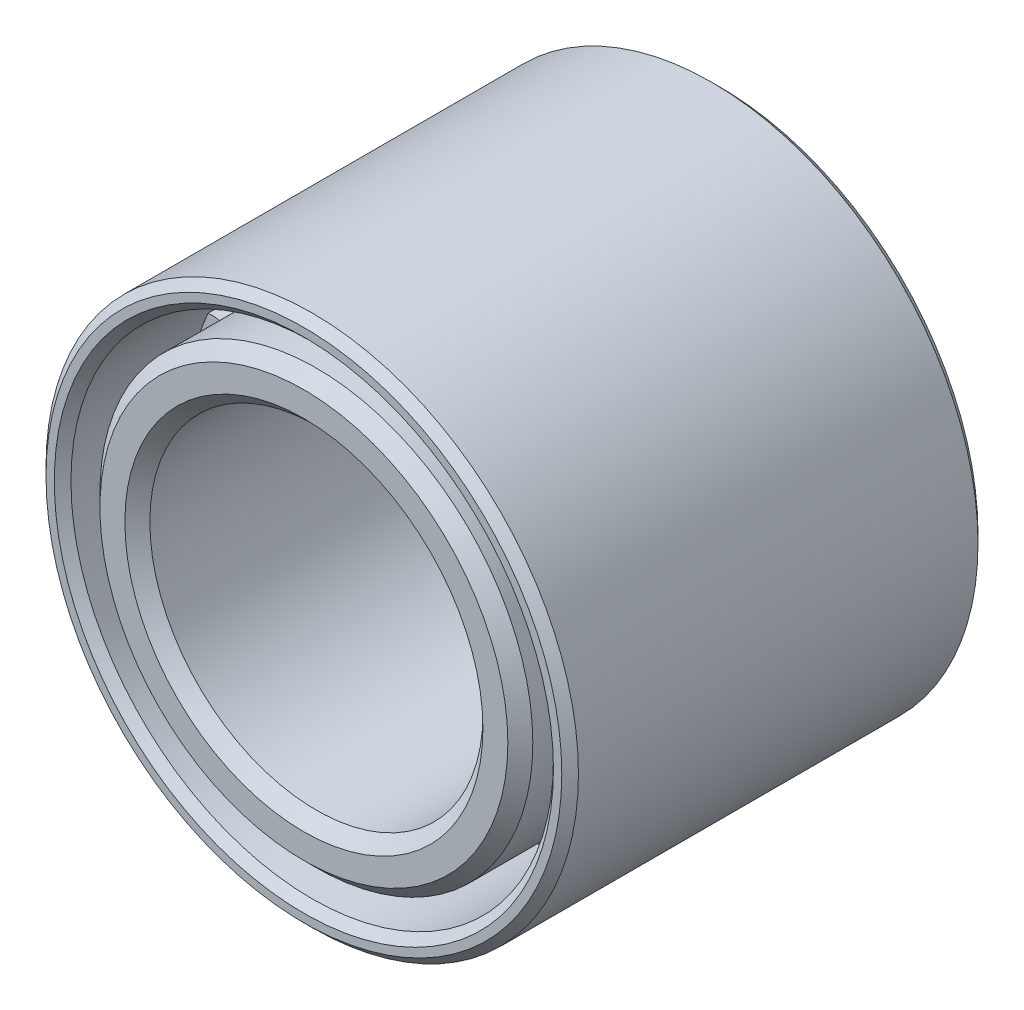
SolidWorks part; units mm, degrees
ref_plane "Front" through (0, 0, 0) normal (0, 0, 1) x (1, 0, 0)
ref_plane "Top" through (0, 0, 0) normal (0, 1, 0) x (1, 0, 0)
ref_plane "Right" through (0, 0, 0) normal (1, 0, 0) x (0, 0, -1)
sketch "Sketch1" plane through (0, 0, 0) normal (0, 0, 1) x (1, 0, 0)
  circle A0 centre (0, 0) radius 10.163
  circle A1 centre (0, 0) radius 13.208
extrude "Extrude1" add sketch "Sketch1" along normal blind 25.4
chamfer "Chamfer1" distance 0.762 angle 45
sketch "Sketch2" plane through (0, 0, 25.4) normal (0, 0, 1) x (1, 0, 0)
  circle A0 centre (0, 0) radius 14.7224
  circle A1 centre (0, 0) radius 16.2459
extrude "Extrude2" add sketch "Sketch2" against normal blind 25.4
chamfer "Chamfer2" distance 0.508 angle 45
chamfer "Chamfer4" distance 0.508 angle 45
chamfer "Chamfer5" distance 0.508 angle 45
chamfer "Chamfer6" distance 0.508 angle 45
ref_plane "Plane1" through (0, 0, 2.54) normal (0, 0, -1) x (-1, 0, 0)
sketch "Sketch3" plane through (0, 0, 2.54) normal (0, 0, -1) x (-1, 0, 0)
  circle A0 centre (0, 13.8954) radius 1.6643
  circle A1 centre (8.1675, 11.2416) radius 1.6643
  circle A2 centre (13.2153, 4.2939) radius 1.6643
  circle A3 centre (13.2153, -4.2939) radius 1.6643
  circle A4 centre (8.1675, -11.2416) radius 1.6643
  circle A5 centre (0, -13.8954) radius 1.6643
  circle A6 centre (-8.1675, -11.2416) radius 1.6643
  circle A7 centre (-13.2153, -4.2939) radius 1.6643
  circle A8 centre (-13.2153, 4.2939) radius 1.6643
  circle A9 centre (-8.1675, 11.2416) radius 1.6643
extrude "Extrude3" add sketch "Sketch3" against normal blind 15.24
